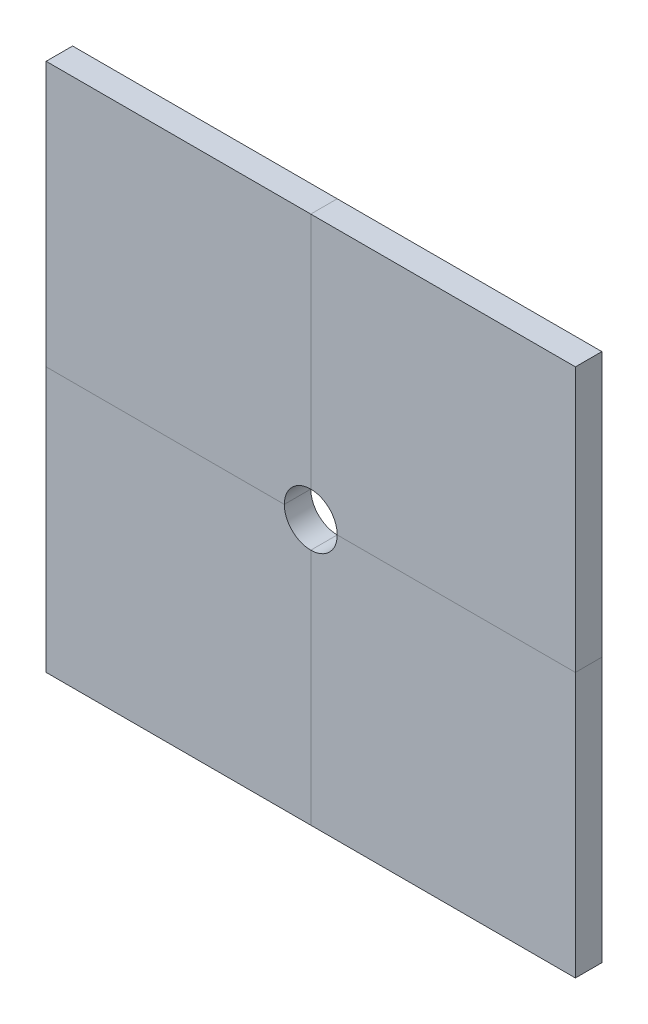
SolidWorks part; units mm, degrees
ref_plane "Plane1" through (0, 0, 0) normal (0, 0, 1) x (1, 0, 0)
ref_plane "Plane2" through (0, 0, 0) normal (0, 1, 0) x (1, 0, 0)
ref_plane "Plane3" through (0, 0, 0) normal (1, 0, 0) x (0, 0, -1)
sketch "Sketch1" plane through (0, 0, 0) normal (0, 0, 1) x (1, 0, 0)
  line L0 (-25.4, -152.4) -> (-25.4, 76.2)
  line L1 (-25.4, 76.2) -> (228.6, 76.2)
  line L2 (228.6, 76.2) -> (228.6, -177.8)
  line L3 (228.6, -177.8) -> (0, -177.8)
  arc A0 (-25.4, -152.4) -> (0, -177.8) centre (-25.4, -177.8) cw
  dimension "D4" = 25.4
  dimension "D1" = 254
  dimension "D2" = 254
  dimension "D3" = 228.6
extrude "Base-Extrude" add sketch "Sketch1" along normal blind 25.4
mirror "Mirror1" about plane through (-25.4, -152.4, 25.4) normal (1, 0, 0)
mirror "Mirror2" about plane through (-279.4, -177.8, 25.4) normal (0, 1, 0)
